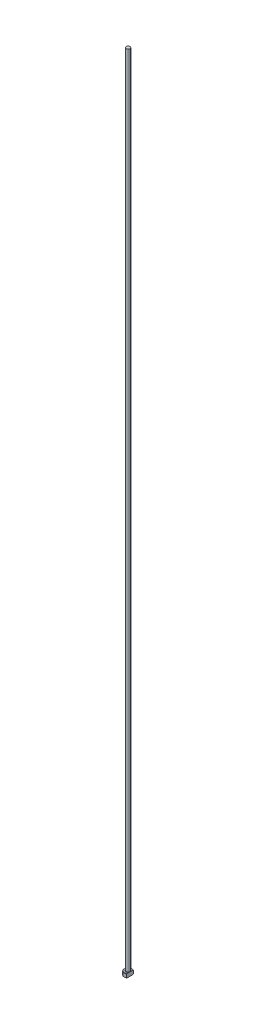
SolidWorks part; units mm, degrees
ref_plane "Front Plane" through (0, 0, 0) normal (0, 0, 1) x (1, 0, 0)
ref_plane "Top Plane" through (0, 0, 0) normal (0, 1, 0) x (1, 0, 0)
ref_plane "Right Plane" through (0, 0, 0) normal (1, 0, 0) x (0, 0, -1)
sketch "Sketch1" plane through (0, 0, 0) normal (0, 0, 1) x (1, 0, 0)
  line L0 (0, 259.9588) -> (0, -15.1925) construction
  line L1 (0, 0) -> (-3, 0)
  line L2 (-3, 0) -> (-3, 3)
  line L3 (-3, 3) -> (-1.5, 3)
  line L4 (-1.5, 3) -> (-1.5, 630)
  line L5 (-1.5, 630) -> (0, 630)
  line L6 (0, 630) -> (0, 0)
  dimension "L" = 630
  dimension "H" = 6
  dimension "T" = 3
  dimension "D" = 3
revolve "Revolve1" add sketch "Sketch1" angle 360 about L0
chamfer "Chamfer1" distance 0.2 angle 45 2 edges at (0, 3, 3) (0, 0, 3)
fillet "Fillet1" radius 0.2 1 edges at (0, 3, 1.5)
sketch "Sketch2" plane through (0, 0, 0) normal (0, 1, 0) x (1, 0, 0)
  line L0 (1.5, 2.5981) -> (1.5, -2.5981)
  circle A0 centre (0, 0) radius 3 construction
  arc A1 (1.5, -2.5981) -> (1.5, 2.5981) centre (0, 0) ccw
  circle A2 centre (0, 0) radius 1.5 construction
extrude "KEY" cut sketch "Sketch2" along normal through all
